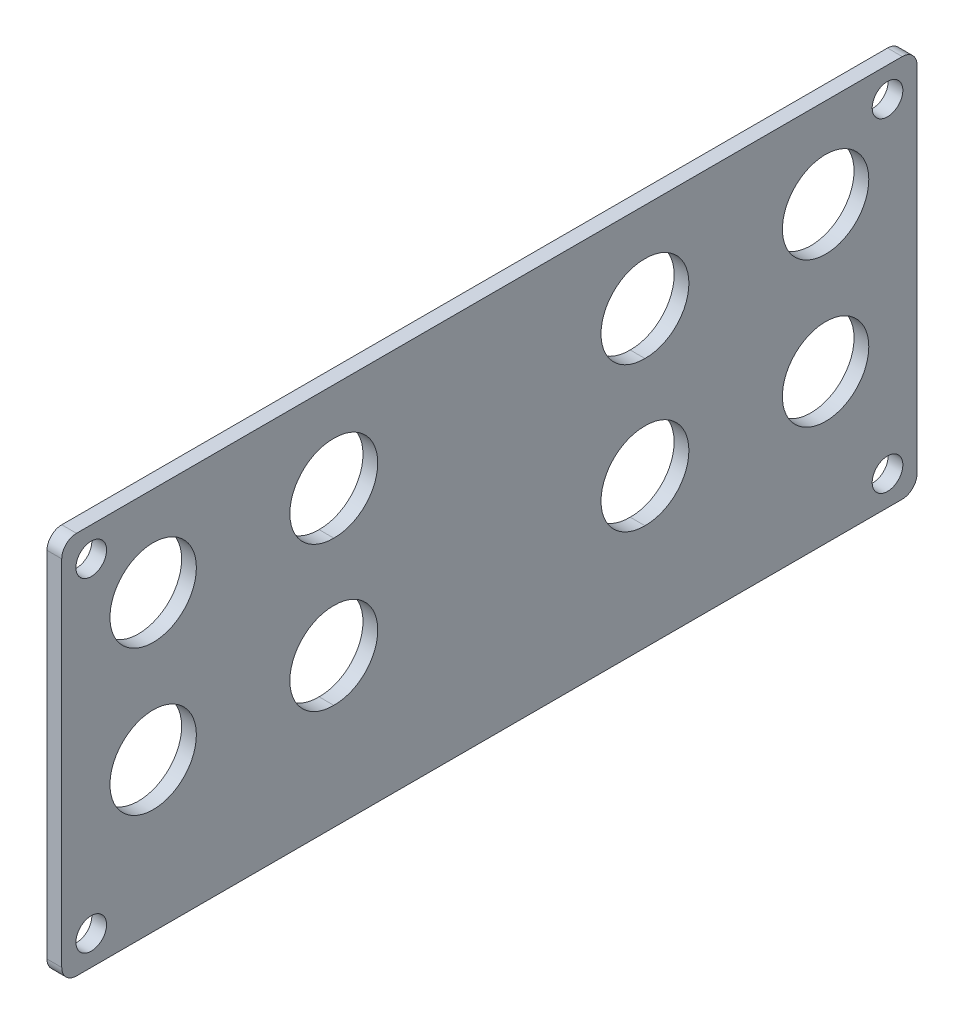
SolidWorks part; units mm, degrees
other "<Endplate-43>-<Fillet1>"
ref_plane "Front Plane" through (0, 0, 0) normal (0, 0, 1) x (1, 0, 0)
ref_plane "Top Plane" through (0, 0, 0) normal (0, 1, 0) x (1, 0, 0)
ref_plane "Right Plane" through (0, 0, 0) normal (1, 0, 0) x (0, 0, -1)
inserted part "Endplate-43"
sketch "Sketch1" plane through (-32.1807, 0, 0) normal (1, 0, 0) x (0, 0, -1)
  line L1 (1.5447, -61.3781) -> (66.5158, -61.3781)
  line L2 (1.5447, -61.3781) -> (1.5447, -69.6481)
  line L3 (1.5447, -69.6481) -> (66.5158, -69.6481)
  line L4 (66.5158, -61.3781) -> (66.5158, -69.6481)
extrude "Boss-Extrude1" add sketch "Sketch1" against normal up to surface (1.27 mm away)
ref_plane "Plane1" through (0, 0, -34.3798) normal (0, 0, 1) x (1, 0, 0)
sketch "Sketch2" plane through (-32.1807, 0, 0) normal (1, 0, 0) x (0, 0, -1)
  circle A0 centre (63.3358, -61.3892) radius 3.7211
  circle A1 centre (68.6698, -71.6762) radius 1.3208 construction
  circle A2 centre (47.7148, -61.3892) radius 3.7211
  circle A3 centre (20.9178, -61.3892) radius 3.7211
  circle A4 centre (5.4238, -61.3892) radius 3.7211
  circle A5 centre (63.3358, -48.9178) radius 3.7211
  circle A6 centre (47.7148, -48.9178) radius 3.7211
  circle A7 centre (20.9178, -48.9178) radius 3.7211
  circle A8 centre (5.4238, -48.9178) radius 3.7211
other "AlignGroup1" parameters "D1"=5.9369, "D3"=2.6416, "D2"=11.4496, "D5"=20.955, "D6"=34.29, "D7"=9.7691, "D8"=9.779, "D9"=12.7508, "D4"=2
extrude "Cut-Extrude1" cut sketch "Sketch2" against normal through all
mirror "Mirror1" about plane through (0, 0, -34.3798) normal (0, 0, 1) of "Cut-Extrude1"
